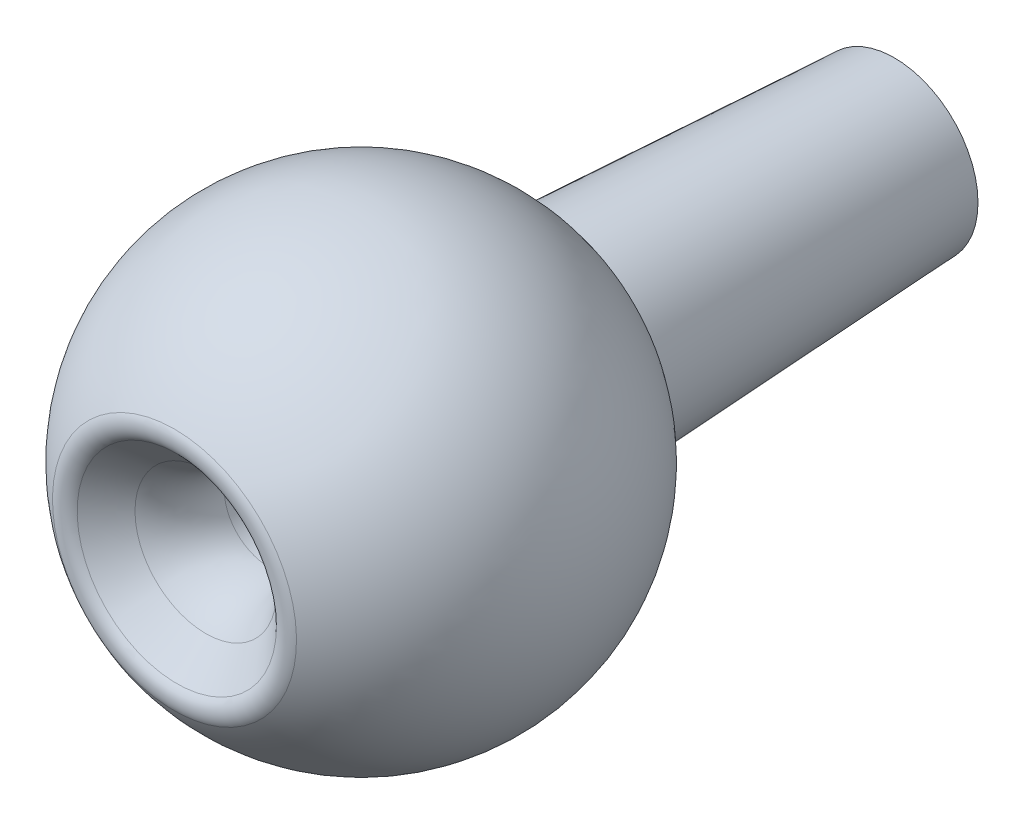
SolidWorks part; units mm, degrees
ref_plane "Front Plane" through (0, 0, 0) normal (0, 0, 1) x (1, 0, 0)
ref_plane "Top Plane" through (0, 0, 0) normal (0, 1, 0) x (1, 0, 0)
ref_plane "Right Plane" through (0, 0, 0) normal (1, 0, 0) x (0, 0, -1)
sketch "Sketch1" plane through (0, 0, 0) normal (0, 0, 1) x (1, 0, 0)
  circle A0 centre (0, 0) radius 2.3813
  dimension "D1" = 4.7625
extrude "Boss-Extrude1" add sketch "Sketch1" along normal blind 9.525 draft 3
sketch "Sketch4" plane through (0, 0, 0) normal (1, 0, 0) x (0, 0, -1)
  line L0 (0, 0) -> (-15.1841, 0) construction
  line L1 (-21.5341, 0) -> (-15.1841, 0) construction
  line L2 (-21.5341, 0) -> (-8.8341, 0)
  arc A0 (-8.8341, 0) -> (-21.5341, 0) centre (-15.1841, 0) ccw
  dimension "D1" = 12.7
revolve "Revolve1" add sketch "Sketch4" angle 360 about L2
sketch "Sketch3" plane through (0, 0, 0) normal (0, 0, -1) x (-1, 0, 0)
  circle A0 centre (0, 0) radius 1.27
  dimension "D1" = 2.54
extrude "Cut-Extrude2" cut sketch "Sketch3" against normal through all
chamfer "Chamfer1" distance 2.54 angle 45 1 edges at (-1.27, 0, 21.4058)
fillet "Fillet1" radius 2.54 1 edges at (-1.27, 0, 18.8658)
fillet "Fillet2" radius 0.508 1 edges at (-3.1193, 0, 20.7151)
